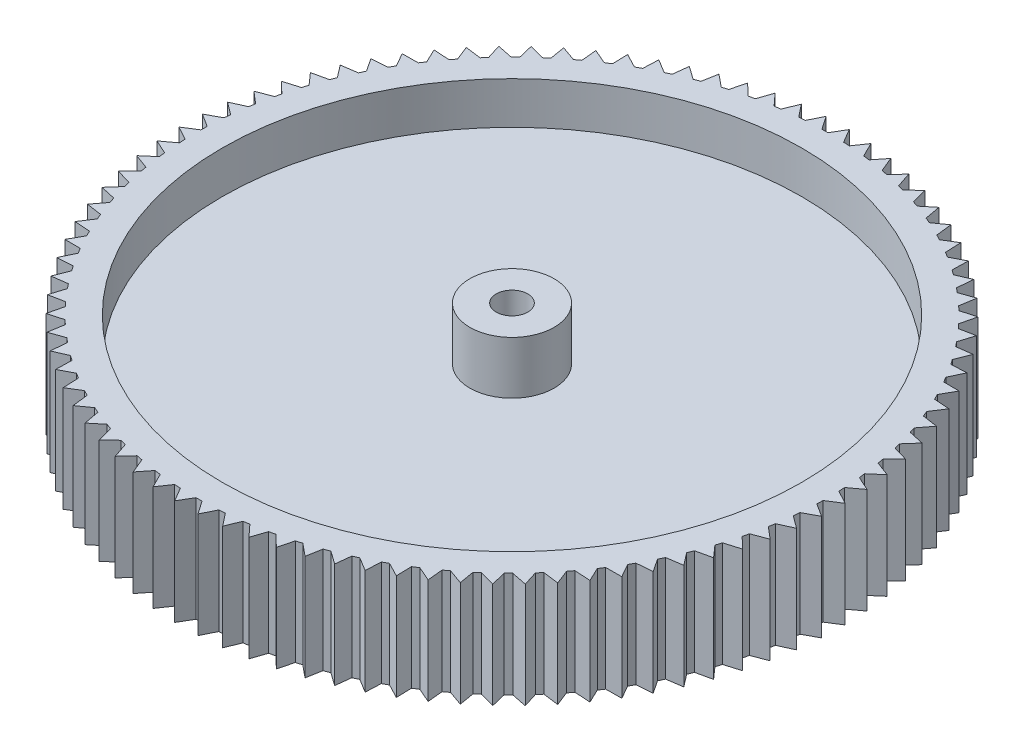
SolidWorks part; units mm, degrees
ref_plane "Front Plane" through (0, 0, 0) normal (0, 0, 1) x (1, 0, 0)
ref_plane "Top Plane" through (0, 0, 0) normal (0, 1, 0) x (1, 0, 0)
ref_plane "Right Plane" through (0, 0, 0) normal (1, 0, 0) x (0, 0, -1)
sketch "Sketch1" plane through (0, 0, 0) normal (0, 1, 0) x (1, 0, 0)
  circle A0 centre (0, 0) radius 12.0584
extrude "Boss-Extrude1" add sketch "Sketch1" along normal blind 10
ref_plane "Plane1" through (0, 5, 0) normal (0, 1, 0) x (1, 0, 0)
sketch "Sketch2" plane through (0, 5, 0) normal (0, 1, 0) x (1, 0, 0)
  circle A0 centre (0, 0) radius 30
  dimension "D1" = 60
extrude "Boss-Extrude3" add sketch "Sketch2" along normal mid plane 10 contours A0
sketch "Sketch3" plane through (0, 10, 0) normal (0, 1, 0) x (1, 0, 0)
  circle A0 centre (0, 0) radius 27.5
  dimension "D1" = 55
extrude "Cut-Extrude1" cut sketch "Sketch3" against normal blind 4
sketch "Sketch4" plane through (0, 0, 0) normal (0, -1, 0) x (1, 0, 0)
  circle A0 centre (0, 0) radius 27.5
  dimension "D1" = 55
extrude "Cut-Extrude2" cut sketch "Sketch4" against normal blind 4
sketch "Sketch5" plane through (0, 6, 0) normal (0, 1, 0) x (1, 0, 0)
  circle A0 centre (0, 0) radius 4
  circle A1 centre (0, 0) radius 1.5
  dimension "D1" = 8
  dimension "D2" = 3
extrude "Boss-Extrude4" add sketch "Sketch5" along normal mid plane 10 contours A0
sketch "Sketch6" plane through (0, 1, 0) normal (0, -1, 0) x (1, 0, 0)
  circle A0 centre (0, 0) radius 1.5
  dimension "D1" = 3
extrude "Cut-Extrude3" cut sketch "Sketch6" against normal blind 10
sketch "Sketch8" plane through (0, 10, 0) normal (0, 1, 0) x (1, 0, 0)
  line L0 (0, 30) -> (0.7466, 31.2704)
  line L1 (0.7466, 31.2704) -> (1.5196, 29.9615)
  line L2 (0, 30) -> (1.5196, 29.9615)
  line L3 (2.9261, 31.1421) -> (3.6059, 29.7825)
  line L4 (2.0927, 29.9269) -> (2.9261, 31.1421)
  line L5 (2.0927, 29.9269) -> (3.6059, 29.7825)
  line L6 (5.0913, 30.8621) -> (5.6747, 29.4584)
  line L7 (4.1752, 29.708) -> (5.0913, 30.8621)
  line L8 (4.1752, 29.708) -> (5.6747, 29.4584)
  line L9 (7.2318, 30.4318) -> (7.7157, 28.9908)
  line L10 (6.2374, 29.3444) -> (7.2318, 30.4318)
  line L11 (6.2374, 29.3444) -> (7.7157, 28.9908)
  line L12 (9.337, 29.8532) -> (9.7192, 28.382)
  line L13 (8.2691, 28.8379) -> (9.337, 29.8532)
  line L14 (8.2691, 28.8379) -> (9.7192, 28.382)
  line L15 (11.3967, 29.1292) -> (11.6754, 27.6349)
  line L16 (10.2606, 28.1908) -> (11.3967, 29.1292)
  line L17 (10.2606, 28.1908) -> (11.6754, 27.6349)
  line L18 (13.4009, 28.2632) -> (13.5747, 26.7531)
  line L19 (12.2021, 27.4064) -> (13.4009, 28.2632)
  line L20 (12.2021, 27.4064) -> (13.5747, 26.7531)
  line L21 (15.3398, 27.2596) -> (15.4078, 25.741)
  line L22 (14.0841, 26.4884) -> (15.3398, 27.2596)
  line L23 (14.0841, 26.4884) -> (15.4078, 25.741)
  line L24 (17.2039, 26.1231) -> (17.1659, 24.6035)
  line L25 (15.8976, 25.4414) -> (17.2039, 26.1231)
  line L26 (15.8976, 25.4414) -> (17.1659, 24.6035)
  line L27 (18.9843, 24.8594) -> (18.8403, 23.3461)
  line L28 (17.6336, 24.2705) -> (18.9843, 24.8594)
  line L29 (17.6336, 24.2705) -> (18.8403, 23.3461)
  line L30 (20.6721, 23.4746) -> (20.423, 21.975)
  line L31 (19.2836, 22.9813) -> (20.6721, 23.4746)
  line L32 (19.2836, 22.9813) -> (20.423, 21.975)
  line L33 (22.2593, 21.9754) -> (21.9061, 20.4969)
  line L34 (20.8398, 21.5802) -> (22.2593, 21.9754)
  line L35 (20.8398, 21.5802) -> (21.9061, 20.4969)
  line L36 (23.738, 20.3691) -> (23.2825, 18.9189)
  line L37 (22.2943, 20.0739) -> (23.738, 20.3691)
  line L38 (22.2943, 20.0739) -> (23.2825, 18.9189)
  line L39 (25.101, 18.6636) -> (24.5455, 17.2487)
  line L40 (23.6403, 18.4698) -> (25.101, 18.6636)
  line L41 (23.6403, 18.4698) -> (24.5455, 17.2487)
  line L42 (26.3418, 16.8672) -> (25.689, 15.4944)
  line L43 (24.8711, 16.7758) -> (26.3418, 16.8672)
  line L44 (24.8711, 16.7758) -> (25.689, 15.4944)
  line L45 (27.4542, 14.9886) -> (26.7072, 13.6647)
  line L46 (25.9808, 15) -> (27.4542, 14.9886)
  line L47 (25.9808, 15) -> (26.7072, 13.6647)
  line L48 (28.4329, 13.037) -> (27.5954, 11.7684)
  line L49 (26.9638, 13.1511) -> (28.4329, 13.037)
  line L50 (26.9638, 13.1511) -> (27.5954, 11.7684)
  line L51 (29.2731, 11.0219) -> (28.3491, 9.8148)
  line L52 (27.8155, 11.2382) -> (29.2731, 11.0219)
  line L53 (27.8155, 11.2382) -> (28.3491, 9.8148)
  line L54 (29.9706, 8.953) -> (28.9647, 7.8134)
  line L55 (28.5317, 9.2705) -> (29.9706, 8.953)
  line L56 (28.5317, 9.2705) -> (28.9647, 7.8134)
  line L57 (30.5221, 6.8406) -> (29.4391, 5.7739)
  line L58 (29.1089, 7.2577) -> (30.5221, 6.8406)
  line L59 (29.1089, 7.2577) -> (29.4391, 5.7739)
  line L60 (30.9249, 4.6948) -> (29.7702, 3.7062)
  line L61 (29.5442, 5.2094) -> (30.9249, 4.6948)
  line L62 (29.5442, 5.2094) -> (29.7702, 3.7062)
  line L63 (31.1771, 2.5261) -> (29.9562, 1.6205)
  line L64 (29.8357, 3.1359) -> (31.1771, 2.5261)
  line L65 (29.8357, 3.1359) -> (29.9562, 1.6205)
  line L66 (31.2774, 0.3452) -> (29.9963, -0.473)
  line L67 (29.9817, 1.047) -> (31.2774, 0.3452)
  line L68 (29.9817, 1.047) -> (29.9963, -0.473)
  line L69 (31.2253, -1.8375) -> (29.8902, -2.5643)
  line L70 (29.9817, -1.047) -> (31.2253, -1.8375)
  line L71 (29.9817, -1.047) -> (29.8902, -2.5643)
  line L72 (31.021, -4.0111) -> (29.6385, -4.6431)
  line L73 (29.8357, -3.1359) -> (31.021, -4.0111)
  line L74 (29.8357, -3.1359) -> (29.6385, -4.6431)
  line L75 (30.6656, -6.1653) -> (29.2424, -6.6993)
  line L76 (29.5442, -5.2094) -> (30.6656, -6.1653)
  line L77 (29.5442, -5.2094) -> (29.2424, -6.6993)
  line L78 (30.1609, -8.2894) -> (28.7039, -8.7228)
  line L79 (29.1089, -7.2577) -> (30.1609, -8.2894)
  line L80 (29.1089, -7.2577) -> (28.7039, -8.7228)
  line L81 (29.5092, -10.3731) -> (28.0255, -10.7038)
  line L82 (28.5317, -9.2705) -> (29.5092, -10.3731)
  line L83 (28.5317, -9.2705) -> (28.0255, -10.7038)
  line L84 (28.7137, -12.4063) -> (27.2106, -12.6327)
  line L85 (27.8155, -11.2382) -> (28.7137, -12.4063)
  line L86 (27.8155, -11.2382) -> (27.2106, -12.6327)
  line L87 (27.7783, -14.3791) -> (26.2631, -14.5001)
  line L88 (26.9638, -13.1511) -> (27.7783, -14.3791)
  line L89 (26.9638, -13.1511) -> (26.2631, -14.5001)
  line L90 (26.7076, -16.2818) -> (25.1876, -16.2968)
  line L91 (25.9808, -15) -> (26.7076, -16.2818)
  line L92 (25.9808, -15) -> (25.1876, -16.2968)
  line L93 (25.5068, -18.1051) -> (23.9894, -18.0141)
  line L94 (24.8711, -16.7758) -> (25.5068, -18.1051)
  line L95 (24.8711, -16.7758) -> (23.9894, -18.0141)
  line L96 (24.1817, -19.8403) -> (22.6744, -19.6436)
  line L97 (23.6403, -18.4698) -> (24.1817, -19.8403)
  line L98 (23.6403, -18.4698) -> (22.6744, -19.6436)
  line L99 (22.7388, -21.4788) -> (21.2489, -21.1774)
  line L100 (22.2943, -20.0739) -> (22.7388, -21.4788)
  line L101 (22.2943, -20.0739) -> (21.2489, -21.1774)
  line L102 (21.1852, -23.0126) -> (19.7199, -22.6081)
  line L103 (20.8398, -21.5802) -> (21.1852, -23.0126)
  line L104 (20.8398, -21.5802) -> (19.7199, -22.6081)
  line L105 (19.5283, -24.4344) -> (18.0948, -23.9286)
  line L106 (19.2836, -22.9813) -> (19.5283, -24.4344)
  line L107 (19.2836, -22.9813) -> (18.0948, -23.9286)
  line L108 (17.7762, -25.7371) -> (16.3815, -25.1326)
  line L109 (17.6336, -24.2705) -> (17.7762, -25.7371)
  line L110 (17.6336, -24.2705) -> (16.3815, -25.1326)
  line L111 (15.9376, -26.9144) -> (14.5885, -26.2141)
  line L112 (15.8976, -25.4414) -> (15.9376, -26.9144)
  line L113 (15.8976, -25.4414) -> (14.5885, -26.2141)
  line L114 (14.0213, -27.9606) -> (12.7243, -27.1678)
  line L115 (14.0841, -26.4884) -> (14.0213, -27.9606)
  line L116 (14.0841, -26.4884) -> (12.7243, -27.1678)
  line L117 (12.0368, -28.8706) -> (10.7982, -27.9893)
  line L118 (12.2021, -27.4064) -> (12.0368, -28.8706)
  line L119 (12.2021, -27.4064) -> (10.7982, -27.9893)
  line L120 (9.9935, -29.6399) -> (8.8195, -28.6743)
  line L121 (10.2606, -28.1908) -> (9.9935, -29.6399)
  line L122 (10.2606, -28.1908) -> (8.8195, -28.6743)
  line L123 (7.9016, -30.2648) -> (6.7978, -29.2197)
  line L124 (8.2691, -28.8379) -> (7.9016, -30.2648)
  line L125 (8.2691, -28.8379) -> (6.7978, -29.2197)
  line L126 (5.7712, -30.7423) -> (4.7429, -29.6227)
  line L127 (6.2374, -29.3444) -> (5.7712, -30.7423)
  line L128 (6.2374, -29.3444) -> (4.7429, -29.6227)
  line L129 (3.6127, -31.0699) -> (2.665, -29.8814)
  line L130 (4.1752, -29.708) -> (3.6127, -31.0699)
  line L131 (4.1752, -29.708) -> (2.665, -29.8814)
  line L132 (1.4365, -31.2463) -> (0.5741, -29.9945)
  line L133 (2.0927, -29.9269) -> (1.4365, -31.2463)
  line L134 (2.0927, -29.9269) -> (0.5741, -29.9945)
  line L135 (-0.7466, -31.2704) -> (-1.5196, -29.9615)
  line L136 (0, -30) -> (-0.7466, -31.2704)
  line L137 (0, -30) -> (-1.5196, -29.9615)
  line L138 (-2.9261, -31.1421) -> (-3.6059, -29.7825)
  line L139 (-2.0927, -29.9269) -> (-2.9261, -31.1421)
  line L140 (-2.0927, -29.9269) -> (-3.6059, -29.7825)
  line L141 (-5.0913, -30.8621) -> (-5.6747, -29.4584)
  line L142 (-4.1752, -29.708) -> (-5.0913, -30.8621)
  line L143 (-4.1752, -29.708) -> (-5.6747, -29.4584)
  line L144 (-7.2318, -30.4318) -> (-7.7157, -28.9908)
  line L145 (-6.2374, -29.3444) -> (-7.2318, -30.4318)
  line L146 (-6.2374, -29.3444) -> (-7.7157, -28.9908)
  line L147 (-9.337, -29.8532) -> (-9.7192, -28.382)
  line L148 (-8.2691, -28.8379) -> (-9.337, -29.8532)
  line L149 (-8.2691, -28.8379) -> (-9.7192, -28.382)
  line L150 (-11.3967, -29.1292) -> (-11.6754, -27.6349)
  line L151 (-10.2606, -28.1908) -> (-11.3967, -29.1292)
  line L152 (-10.2606, -28.1908) -> (-11.6754, -27.6349)
  line L153 (-13.4009, -28.2632) -> (-13.5747, -26.7531)
  line L154 (-12.2021, -27.4064) -> (-13.4009, -28.2632)
  line L155 (-12.2021, -27.4064) -> (-13.5747, -26.7531)
  line L156 (-15.3398, -27.2596) -> (-15.4078, -25.741)
  line L157 (-14.0841, -26.4884) -> (-15.3398, -27.2596)
  line L158 (-14.0841, -26.4884) -> (-15.4078, -25.741)
  line L159 (-17.2039, -26.1231) -> (-17.1659, -24.6035)
  line L160 (-15.8976, -25.4414) -> (-17.2039, -26.1231)
  line L161 (-15.8976, -25.4414) -> (-17.1659, -24.6035)
  line L162 (-18.9843, -24.8594) -> (-18.8403, -23.3461)
  line L163 (-17.6336, -24.2705) -> (-18.9843, -24.8594)
  line L164 (-17.6336, -24.2705) -> (-18.8403, -23.3461)
  line L165 (-20.6721, -23.4746) -> (-20.423, -21.975)
  line L166 (-19.2836, -22.9813) -> (-20.6721, -23.4746)
  line L167 (-19.2836, -22.9813) -> (-20.423, -21.975)
  line L168 (-22.2593, -21.9754) -> (-21.9061, -20.4969)
  line L169 (-20.8398, -21.5802) -> (-22.2593, -21.9754)
  line L170 (-20.8398, -21.5802) -> (-21.9061, -20.4969)
  line L171 (-23.738, -20.3691) -> (-23.2825, -18.9189)
  line L172 (-22.2943, -20.0739) -> (-23.738, -20.3691)
  line L173 (-22.2943, -20.0739) -> (-23.2825, -18.9189)
  line L174 (-25.101, -18.6636) -> (-24.5455, -17.2487)
  line L175 (-23.6403, -18.4698) -> (-25.101, -18.6636)
  line L176 (-23.6403, -18.4698) -> (-24.5455, -17.2487)
  line L177 (-26.3418, -16.8672) -> (-25.689, -15.4944)
  line L178 (-24.8711, -16.7758) -> (-26.3418, -16.8672)
  line L179 (-24.8711, -16.7758) -> (-25.689, -15.4944)
  line L180 (-27.4542, -14.9886) -> (-26.7072, -13.6647)
  line L181 (-25.9808, -15) -> (-27.4542, -14.9886)
  line L182 (-25.9808, -15) -> (-26.7072, -13.6647)
  line L183 (-28.4329, -13.037) -> (-27.5954, -11.7684)
  line L184 (-26.9638, -13.1511) -> (-28.4329, -13.037)
  line L185 (-26.9638, -13.1511) -> (-27.5954, -11.7684)
  line L186 (-29.2731, -11.0219) -> (-28.3491, -9.8148)
  line L187 (-27.8155, -11.2382) -> (-29.2731, -11.0219)
  line L188 (-27.8155, -11.2382) -> (-28.3491, -9.8148)
  line L189 (-29.9706, -8.953) -> (-28.9647, -7.8134)
  line L190 (-28.5317, -9.2705) -> (-29.9706, -8.953)
  line L191 (-28.5317, -9.2705) -> (-28.9647, -7.8134)
  line L192 (-30.5221, -6.8406) -> (-29.4391, -5.7739)
  line L193 (-29.1089, -7.2577) -> (-30.5221, -6.8406)
  line L194 (-29.1089, -7.2577) -> (-29.4391, -5.7739)
  line L195 (-30.9249, -4.6948) -> (-29.7702, -3.7062)
  line L196 (-29.5442, -5.2094) -> (-30.9249, -4.6948)
  line L197 (-29.5442, -5.2094) -> (-29.7702, -3.7062)
  line L198 (-31.1771, -2.5261) -> (-29.9562, -1.6205)
  line L199 (-29.8357, -3.1359) -> (-31.1771, -2.5261)
  line L200 (-29.8357, -3.1359) -> (-29.9562, -1.6205)
  line L201 (-31.2774, -0.3452) -> (-29.9963, 0.473)
  line L202 (-29.9817, -1.047) -> (-31.2774, -0.3452)
  line L203 (-29.9817, -1.047) -> (-29.9963, 0.473)
  line L204 (-31.2253, 1.8375) -> (-29.8902, 2.5643)
  line L205 (-29.9817, 1.047) -> (-31.2253, 1.8375)
  line L206 (-29.9817, 1.047) -> (-29.8902, 2.5643)
  line L207 (-31.021, 4.0111) -> (-29.6385, 4.6431)
  line L208 (-29.8357, 3.1359) -> (-31.021, 4.0111)
  line L209 (-29.8357, 3.1359) -> (-29.6385, 4.6431)
  line L210 (-30.6656, 6.1653) -> (-29.2424, 6.6993)
  line L211 (-29.5442, 5.2094) -> (-30.6656, 6.1653)
  line L212 (-29.5442, 5.2094) -> (-29.2424, 6.6993)
  line L213 (-30.1609, 8.2894) -> (-28.7039, 8.7228)
  line L214 (-29.1089, 7.2577) -> (-30.1609, 8.2894)
  line L215 (-29.1089, 7.2577) -> (-28.7039, 8.7228)
  line L216 (-29.5092, 10.3731) -> (-28.0255, 10.7038)
  line L217 (-28.5317, 9.2705) -> (-29.5092, 10.3731)
  line L218 (-28.5317, 9.2705) -> (-28.0255, 10.7038)
  line L219 (-28.7137, 12.4063) -> (-27.2106, 12.6327)
  line L220 (-27.8155, 11.2382) -> (-28.7137, 12.4063)
  line L221 (-27.8155, 11.2382) -> (-27.2106, 12.6327)
  line L222 (-27.7783, 14.3791) -> (-26.2631, 14.5001)
  line L223 (-26.9638, 13.1511) -> (-27.7783, 14.3791)
  line L224 (-26.9638, 13.1511) -> (-26.2631, 14.5001)
  line L225 (-26.7076, 16.2818) -> (-25.1876, 16.2968)
  line L226 (-25.9808, 15) -> (-26.7076, 16.2818)
  line L227 (-25.9808, 15) -> (-25.1876, 16.2968)
  line L228 (-25.5068, 18.1051) -> (-23.9894, 18.0141)
  line L229 (-24.8711, 16.7758) -> (-25.5068, 18.1051)
  line L230 (-24.8711, 16.7758) -> (-23.9894, 18.0141)
  line L231 (-24.1817, 19.8403) -> (-22.6744, 19.6436)
  line L232 (-23.6403, 18.4698) -> (-24.1817, 19.8403)
  line L233 (-23.6403, 18.4698) -> (-22.6744, 19.6436)
  line L234 (-22.7388, 21.4788) -> (-21.2489, 21.1774)
  line L235 (-22.2943, 20.0739) -> (-22.7388, 21.4788)
  line L236 (-22.2943, 20.0739) -> (-21.2489, 21.1774)
  line L237 (-21.1852, 23.0126) -> (-19.7199, 22.6081)
  line L238 (-20.8398, 21.5802) -> (-21.1852, 23.0126)
  line L239 (-20.8398, 21.5802) -> (-19.7199, 22.6081)
  line L240 (-19.5283, 24.4344) -> (-18.0948, 23.9286)
  line L241 (-19.2836, 22.9813) -> (-19.5283, 24.4344)
  line L242 (-19.2836, 22.9813) -> (-18.0948, 23.9286)
  line L243 (-17.7762, 25.7371) -> (-16.3815, 25.1326)
  line L244 (-17.6336, 24.2705) -> (-17.7762, 25.7371)
  line L245 (-17.6336, 24.2705) -> (-16.3815, 25.1326)
  line L246 (-15.9376, 26.9144) -> (-14.5885, 26.2141)
  line L247 (-15.8976, 25.4414) -> (-15.9376, 26.9144)
  line L248 (-15.8976, 25.4414) -> (-14.5885, 26.2141)
  line L249 (-14.0213, 27.9606) -> (-12.7243, 27.1678)
  line L250 (-14.0841, 26.4884) -> (-14.0213, 27.9606)
  line L251 (-14.0841, 26.4884) -> (-12.7243, 27.1678)
  line L252 (-12.0368, 28.8706) -> (-10.7982, 27.9893)
  line L253 (-12.2021, 27.4064) -> (-12.0368, 28.8706)
  line L254 (-12.2021, 27.4064) -> (-10.7982, 27.9893)
  line L255 (-9.9935, 29.6399) -> (-8.8195, 28.6743)
  line L256 (-10.2606, 28.1908) -> (-9.9935, 29.6399)
  line L257 (-10.2606, 28.1908) -> (-8.8195, 28.6743)
  line L258 (-7.9016, 30.2648) -> (-6.7978, 29.2197)
  line L259 (-8.2691, 28.8379) -> (-7.9016, 30.2648)
  line L260 (-8.2691, 28.8379) -> (-6.7978, 29.2197)
  line L261 (-5.7712, 30.7423) -> (-4.7429, 29.6227)
  line L262 (-6.2374, 29.3444) -> (-5.7712, 30.7423)
  line L263 (-6.2374, 29.3444) -> (-4.7429, 29.6227)
  line L264 (-3.6127, 31.0699) -> (-2.665, 29.8814)
  line L265 (-4.1752, 29.708) -> (-3.6127, 31.0699)
  line L266 (-4.1752, 29.708) -> (-2.665, 29.8814)
  line L267 (-1.4365, 31.2463) -> (-0.5741, 29.9945)
  line L268 (-2.0927, 29.9269) -> (-1.4365, 31.2463)
  line L269 (-2.0927, 29.9269) -> (-0.5741, 29.9945)
  circle A0 centre (0, 0) radius 30 construction
  point P274 (0, 0)
  dimension "D1" = 90
extrude "Boss-Extrude5" add sketch "Sketch8" against normal blind 10
